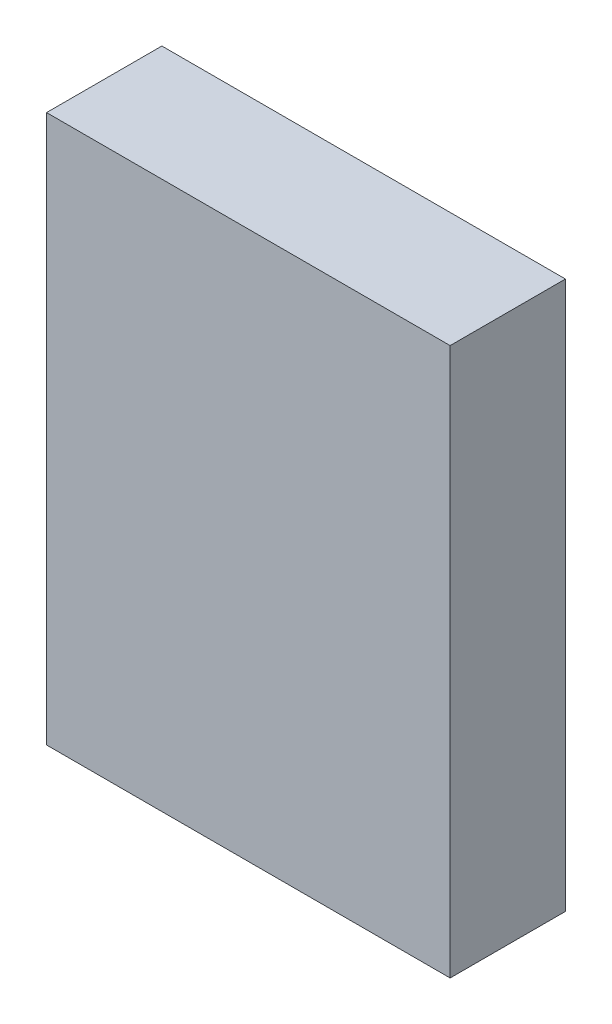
SolidWorks part; units mm, degrees
ref_plane "Front Plane" through (0, 0, 0) normal (0, 0, 1) x (1, 0, 0)
ref_plane "Top Plane" through (0, 0, 0) normal (0, 1, 0) x (1, 0, 0)
ref_plane "Right Plane" through (0, 0, 0) normal (1, 0, 0) x (0, 0, -1)
sketch "Sketch1" plane through (0, 0, 0) normal (0, 0, 1) x (1, 0, 0)
  line L1 (-17.5, -23.75) -> (17.5, -23.75)
  line L2 (-17.5, -23.75) -> (-17.5, 23.75)
  line L3 (-17.5, 23.75) -> (17.5, 23.75)
  line L4 (17.5, -23.75) -> (17.5, 23.75)
  line L5 (-17.5, -23.75) -> (17.5, 23.75) construction
  line L6 (-17.5, 23.75) -> (17.5, -23.75) construction
  point P0 (0, 0)
  dimension "D1" = 35
  dimension "D2" = 47.5
extrude "Boss-Extrude1" add sketch "Sketch1" along normal blind 10
